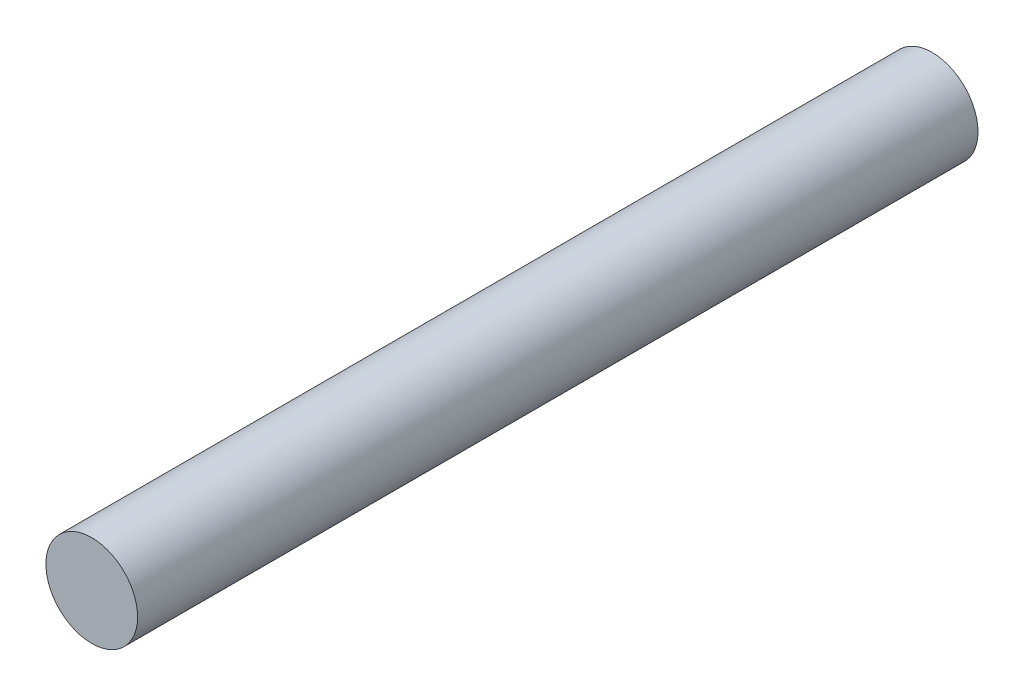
SolidWorks part; units mm, degrees
ref_plane "Front Plane" through (0, 0, 0) normal (0, 0, 1) x (1, 0, 0)
ref_plane "Top Plane" through (0, 0, 0) normal (0, 1, 0) x (1, 0, 0)
ref_plane "Right Plane" through (0, 0, 0) normal (1, 0, 0) x (0, 0, -1)
sketch "Sketch1" plane through (0, 0, 0) normal (0, 0, 1) x (1, 0, 0)
  circle A0 centre (0, 0) radius 30
  dimension "D1" = 60
extrude "Boss-Extrude1" add sketch "Sketch1" against normal blind 550
